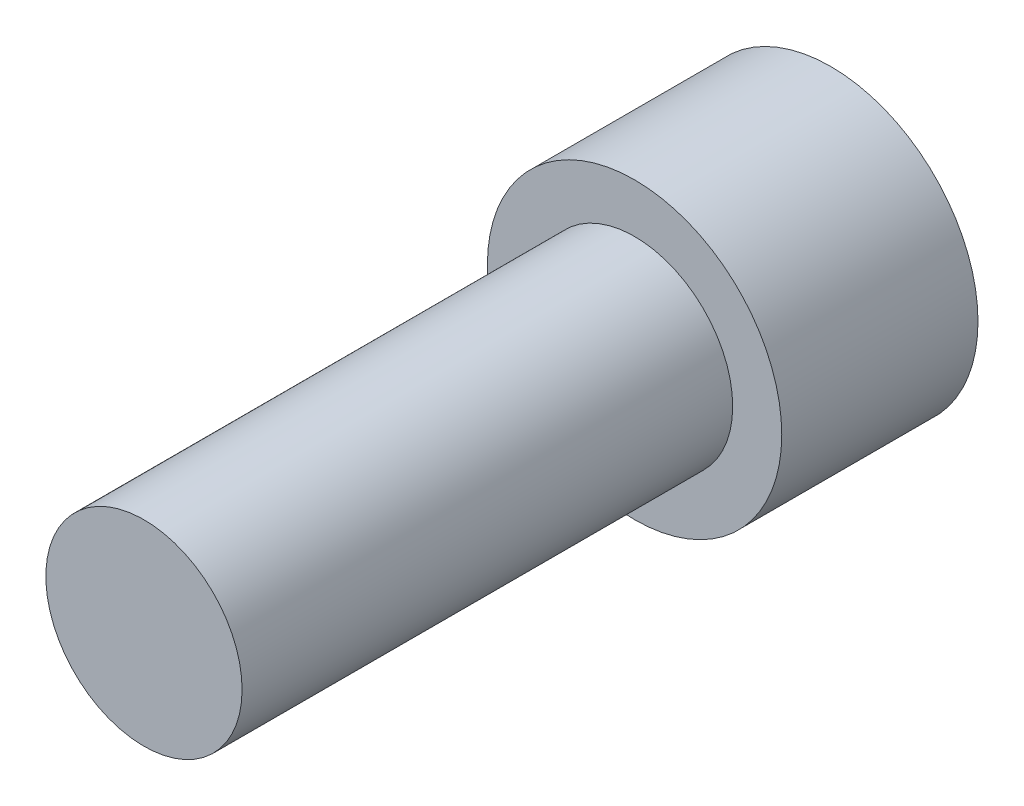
SolidWorks part; units mm, degrees
ref_plane "Front Plane" through (0, 0, 0) normal (0, 0, 1) x (1, 0, 0)
ref_plane "Top Plane" through (0, 0, 0) normal (0, 1, 0) x (1, 0, 0)
ref_plane "Right Plane" through (0, 0, 0) normal (1, 0, 0) x (0, 0, -1)
sketch "Sketch6" plane through (0, 0, 0) normal (1, 0, 0) x (0, 0, -1)
  line L0 (-31.75, 0) -> (22.525, 0) construction
  line L1 (10.4775, 0) -> (-10.4775, 0) construction
  line L2 (-31.75, 0) -> (-31.75, -6.35)
  line L3 (-31.75, -6.35) -> (0, -6.35)
  line L4 (0, 10.4775) -> (0, -10.4775) construction
  line L5 (0, -6.35) -> (0, -9.525)
  line L6 (0, -9.525) -> (12.7, -9.525)
  line L7 (12.7, -9.525) -> (12.7, 0)
  line L8 (12.7, 0) -> (-31.75, 0)
  dimension "L" = 31.75
  dimension "H" = 12.7
  dimension "A" = 19.05
  dimension "D" = 12.7
revolve "Revolve1" add sketch "Sketch6" angle 360 about L0
sketch "Sketch7" plane through (0, 0, -12.7) normal (0, 0, -1) x (-1, 0, 0)
  line L2 (-4.7625, 2.7496) -> (-4.7625, -2.7496)
  line L4 (-4.7625, -2.7496) -> (0, -5.4993)
  line L5 (0, -5.4993) -> (4.7625, -2.7496)
  line L6 (4.7625, -2.7496) -> (4.7625, 2.7496)
  line L7 (4.7625, 2.7496) -> (0, 5.4993)
  line L8 (0, 5.4993) -> (-4.7625, 2.7496)
  circle A0 centre (0, 0) radius 4.7625 construction
  dimension "J" = 9.525
extrude "HEX" cut sketch "Sketch7" against normal blind 7.112
